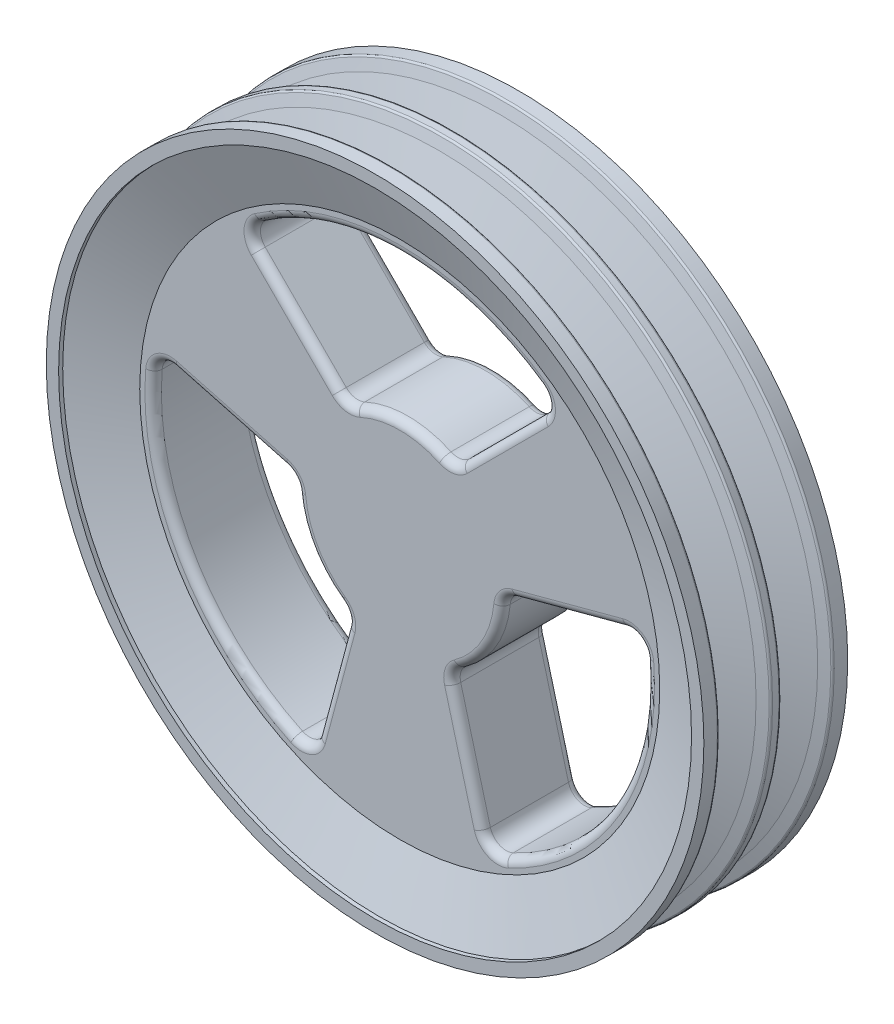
SolidWorks part; units mm, degrees
ref_plane "Ebene vorne" through (0, 0, 0) normal (0, 0, 1) x (1, 0, 0)
ref_plane "Ebene oben" through (0, 0, 0) normal (0, 1, 0) x (1, 0, 0)
ref_plane "Ebene rechts" through (0, 0, 0) normal (1, 0, 0) x (0, 0, -1)
sketch "Skizze1" plane through (0, 0, 0) normal (0, 0, 1) x (1, 0, 0)
  circle A0 centre (0, 0) radius 80
  dimension "D1" = 160
extrude "Linear austragen1" add sketch "Skizze1" along normal mid plane 35
sketch "Skizze2" plane through (0, 0, 0) normal (1, 0, 0) x (0, 0, -1)
  line L0 (-13.85, 80) -> (-13, 77.2)
  line L1 (17.5, 80) -> (-17.5, 80) construction
  line L2 (-13, 77.2) -> (-9.2124, 66.2)
  line L3 (-9.2124, 66.2) -> (-5.7876, 66.2)
  line L4 (-5.7876, 66.2) -> (-2, 77.2)
  line L5 (-2, 77.2) -> (-1.15, 80)
  line L6 (-1.15, 80) -> (-13.85, 80)
  line L7 (-7.5, 55.3109) -> (-7.5, 87.0349) construction
  line L9 (-17.5, 80) -> (-17.5, -80) construction
  dimension "D1" = 10
  dimension "D2" = 38
  dimension "D3" = 11
  dimension "D4" = 12.7
  dimension "D5" = 13.8
  dimension "D6" = 2.8
revolve "Schnitt-Rotation1" cut sketch "Skizze2" angle 360 about axis through (0, 0, 17.5) along (0, 0, -1)
fillet "Verrundung1" radius 0.5 4 edges at (80, 0, 1.15) (80, 0, 13.85) (66.2, 0, 5.7876) (66.2, 0, 9.2124)
pattern_linear "Lineares Muster1" count 2 spacing 15 along (0, 0, -1) of "Schnitt-Rotation1", "Verrundung1"
sketch "Skizze3" plane through (0, 0, 0) normal (1, 0, 0) x (0, 0, -1)
  line L0 (-11.5, 0) -> (-11.5, 63.2626)
  line L1 (-11.5, 63.2626) -> (-16.5, 77)
  line L2 (-16.5, 77) -> (-17.5, 77)
  line L3 (-17.5, 80) -> (-17.5, -80) construction
  line L4 (-17.5, 77) -> (-17.5, 0)
  line L5 (-17.5, 0) -> (-11.5, 0)
  line L6 (17.5, 77) -> (16.5, 77)
  line L7 (17.5, -80) -> (17.5, 80) construction
  line L8 (16.5, 77) -> (11.5, 63.2626)
  line L9 (11.5, 63.2626) -> (11.5, 0)
  line L10 (11.5, 0) -> (17.5, 0)
  line L11 (17.5, 0) -> (17.5, 77)
  dimension "D1" = 6
  dimension "D2" = 160
  dimension "D3" = 1
  dimension "D4" = 77
  dimension "D5" = 6
  dimension "D6" = 77
  dimension "D7" = 1
  dimension "D8" = 160
revolve "Schnitt-Rotation2" cut sketch "Skizze3" angle 360 about axis through (0, 0, 17.5) along (0, 0, -1)
sketch "Skizze4" plane through (0, 0, 0) normal (0, 0, 1) x (1, 0, 0)
  line L0 (0, 0) -> (62.5724, 62.5724) construction
  line L1 (0, 0) -> (-70.8124, 70.8124) construction
  line L2 (0, 0) -> (0, 84.1509) construction
  line L3 (15.0057, 23.491) -> (34.7189, 43.2042)
  line L4 (-15.0057, 23.491) -> (-34.7189, 43.2042)
  line L5 (0, 8.4853) -> (-66.5698, 75.0551) construction
  line L6 (0, 8.4853) -> (58.3298, 66.8151) construction
  arc A0 (10.4977, 22.6892) -> (-10.4977, 22.6892) centre (0, 0) ccw
  arc A1 (34.1683, 49.3206) -> (-34.1683, 49.3206) centre (0, 0) ccw
  arc A2 (-34.7189, 43.2042) -> (-34.1683, 49.3206) centre (-31.8905, 46.0326) cw
  arc A3 (-15.0057, 23.491) -> (-10.4977, 22.6892) centre (-12.1773, 26.3194) ccw
  arc A4 (10.4977, 22.6892) -> (15.0057, 23.491) centre (12.1773, 26.3194) ccw
  arc A5 (34.7189, 43.2042) -> (34.1683, 49.3206) centre (31.8905, 46.0326) ccw
  dimension "D1" = 50
  dimension "D2" = 120
  dimension "D5" = 4
  dimension "D4" = 45
  dimension "D3" = 6
extrude "Schnitt-Linear austragen1" cut sketch "Skizze4" along direction (0, 0, -1) on the side against the normal through all and the other way through all
fillet "Verrundung2" radius 2 16 edges at (-35.8743, 46.3912, -11.5) (0, 60, -11.5) (35.8743, 46.3912, -11.5) (24.8623, 33.3476, -11.5) (12.8778, 22.3813, -11.5) (0, 25, -11.5) (-12.8778, 22.3813, -11.5) (-35.8743, 46.3912, 11.5) (0, 60, 11.5) (35.8743, 46.3912, 11.5) (24.8623, 33.3476, 11.5) (12.8778, 22.3813, 11.5) (0, 25, 11.5) (-12.8778, 22.3813, 11.5) (-24.8623, 33.3476, -11.5) (-24.8623, 33.3476, 11.5)
pattern_circular "Kreismuster1" count 3 over 360 about axis through (0, 0, 0) along (0, 0, 1) of "Verrundung2", "Schnitt-Linear austragen1"
equation "\"D1@Linear austragen1\" = 20 +  (  \"D1@Lineares Muster1\"-1 )  * 15"
